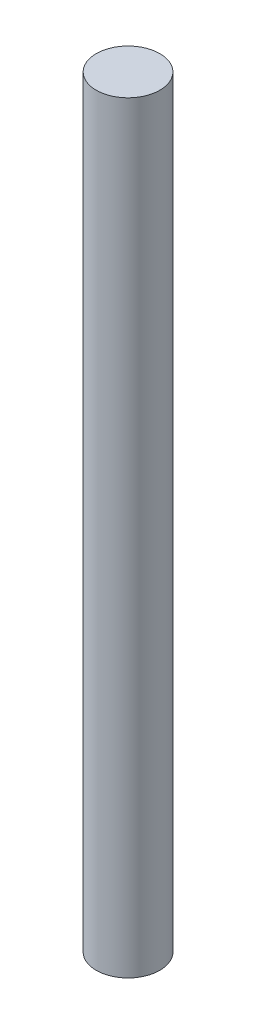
SolidWorks part; units mm, degrees
ref_plane "Piano frontale" through (0, 0, 0) normal (0, 0, 1) x (1, 0, 0)
ref_plane "Piano superiore" through (0, 0, 0) normal (0, 1, 0) x (1, 0, 0)
ref_plane "Piano destro" through (0, 0, 0) normal (1, 0, 0) x (0, 0, -1)
sketch "Schizzo1" plane through (0, 0, 0) normal (0, 0, 1) x (1, 0, 0)
  line L0 (0, 0) -> (0, 71.7184) construction
  line L1 (0, 56.9899) -> (1.5, 56.9899)
  line L2 (1.5, 56.9899) -> (1.5, 20.9899)
  line L3 (1.5, 20.9899) -> (0, 20.9899)
  line L4 (0, 56.9899) -> (0, 20.9899)
  dimension "D1" = 1.5
  dimension "D2" = 36
revolve "Rivoluzione1" add sketch "Schizzo1" angle 360 about L0
